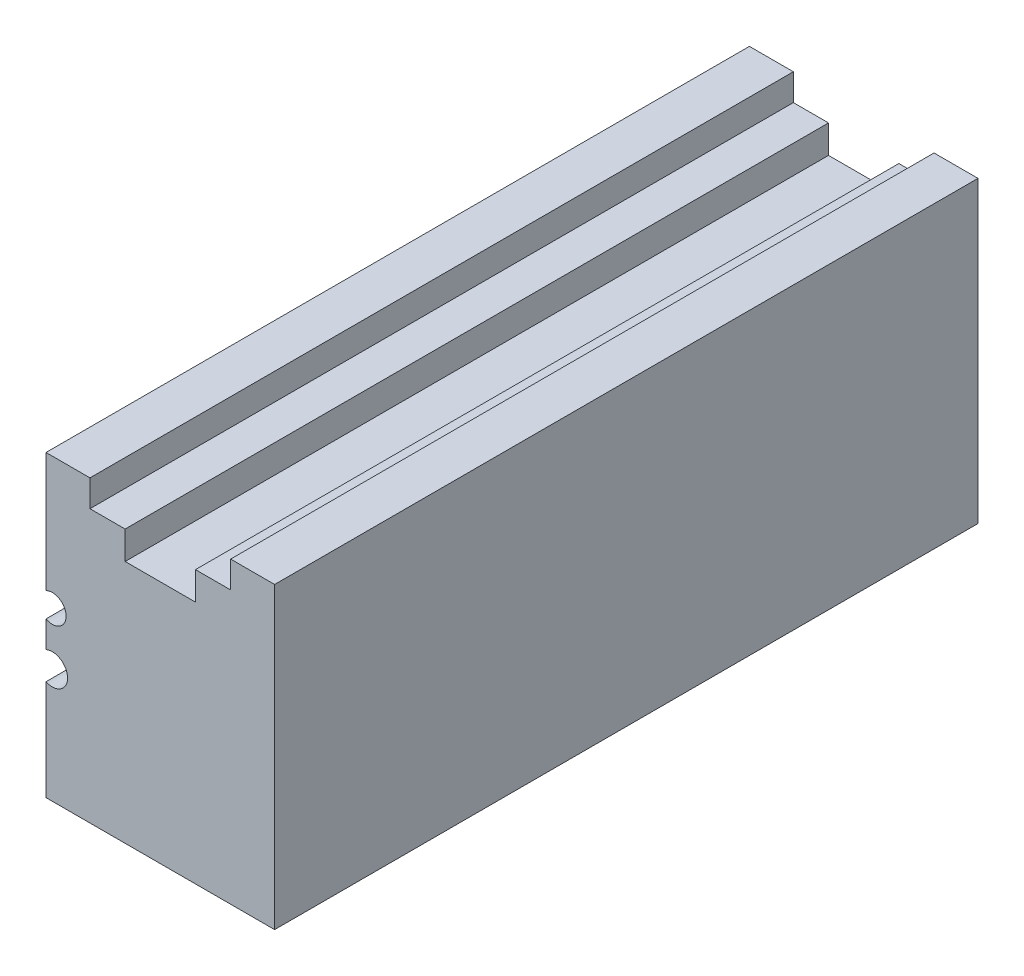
SolidWorks part; units mm, degrees
ref_plane "Front Plane" through (0, 0, 0) normal (0, 0, 1) x (1, 0, 0)
ref_plane "Top Plane" through (0, 0, 0) normal (0, 1, 0) x (1, 0, 0)
ref_plane "Right Plane" through (0, 0, 0) normal (1, 0, 0) x (0, 0, -1)
sketch "Sketch1" plane through (0, 0, 0) normal (0, 0, 1) x (1, 0, 0)
  line L1 (0, 0) -> (41.275, 0)
  line L2 (0, 0) -> (0, 53.975)
  line L3 (0, 53.975) -> (41.275, 53.975)
  line L4 (41.275, 0) -> (41.275, 53.975)
  dimension "D1" = 53.975
  dimension "D2" = 41.275
extrude "Boss-Extrude1" add sketch "Sketch1" against normal blind 127
sketch "Sketch2" plane through (0, 0, 0) normal (0, 0, 1) x (1, 0, 0)
  line L0 (41.275, 53.975) -> (0, 53.975) construction
  line L1 (7.9375, 53.975) -> (33.3375, 53.975)
  line L2 (7.9375, 53.975) -> (7.9375, 49.149)
  line L3 (7.9375, 49.149) -> (14.2875, 49.149)
  line L4 (33.3375, 53.975) -> (33.3375, 49.149)
  line L5 (26.9875, 49.149) -> (33.3375, 49.149)
  line L7 (14.2875, 49.149) -> (14.2875, 44.069)
  line L8 (14.2875, 44.069) -> (26.9875, 44.069)
  line L9 (26.9875, 49.149) -> (26.9875, 44.069)
  line L10 (41.275, 0) -> (41.275, 53.975) construction
  dimension "D1" = 25.4
  dimension "D2" = 12.7
  dimension "D3" = 6.35
  dimension "D4" = 7.9375
  dimension "D5" = 4.826
  dimension "D6" = 9.906
  dimension "D7" = 5.08
  dimension "D8" = 4.826
  dimension "D9" = 5.08
extrude "Cut-Extrude1" cut sketch "Sketch2" against normal blind 127
sketch "Sketch3" plane through (0, 0, 0) normal (0, -1, 0) x (1, 0, 0)
  line L0 (0, 0) -> (41.275, 0) construction
  line L1 (0, -127) -> (0, 0) construction
  circle A0 centre (20.6375, -25.4) radius 2.413
  circle A1 centre (4.7625, -63.5) radius 2.413
  circle A2 centre (36.5125, -63.5) radius 2.413
  circle A3 centre (20.6375, -101.6) radius 2.413
  dimension "D1" = 4.826
  dimension "D2" = 4.826
  dimension "D3" = 4.826
  dimension "D4" = 4.826
  dimension "D6" = 63.5
  dimension "D7" = 38.1
  dimension "D8" = 38.1
  dimension "D9" = 20.6375
  dimension "D10" = 20.6375
  dimension "D11" = 31.75
  dimension "D12" = 4.7625
  dimension "D5" = 63.5
extrude "Cut-Extrude2" cut sketch "Sketch3" against normal blind 6.35
hole_wizard "1/4-20 Tapped Hole1" positions "Sketch4" profile "Sketch5" tap size "1/4-20" standard "ANSI Inch"
sketch "Sketch4" plane through (0, 0, 0) normal (0, -1, 0) x (-1, 0, 0)
  line L0 (0, 127) -> (0, 0) construction
  circle A0 centre (-4.7625, 63.5) radius 2.413 construction
  circle A1 centre (-36.5125, 63.5) radius 2.413 construction
  point P0 (-4.7625, 38.1)
  point P2 (-36.5125, 38.1)
  point P4 (-36.5125, 88.9)
  point P6 (-4.7625, 88.9)
  dimension "D6" = 25.4
  dimension "D7" = 25.4
  dimension "D1" = 4.7625
  dimension "D2" = 31.75
  dimension "D3" = 36.5125
  dimension "D4" = 4.7625
  dimension "D5" = 25.4
  dimension "D8" = 31.75
sketch "Sketch5" plane through (4.7625, 0, -38.1) normal (1, 0, 0) x (0, 0, -1)
  line L0 (0, 0) -> (0, 12.9638)
  line L1 (0, 12.9638) -> (2.5527, 11.43)
  line L2 (2.5527, 11.43) -> (2.5527, 1.2573)
  line L3 (2.5527, 1.2573) -> (3.81, 0)
  line L5 (3.81, 0) -> (0, 0)
  line L6 (-2.5527, 1.2573) -> (-3.81, 0) construction
  line L10 (0, 12.9638) -> (-2.5527, 11.43) construction
  line L11 (0, -6.35) -> (0, 107.95) construction
  dimension "Tap Drill Dia." = 5.1054
  dimension "Tap Drill Depth" = 11.43
  dimension "Near C'Sink Dia." = 7.62
  dimension "Near C'Sink Angle" = 90
  dimension "Drill Angle" = 118
sketch "Sketch6" plane through (0, 0, 0) normal (0, 0, 1) x (1, 0, 0)
  line L0 (7.9375, 53.975) -> (0, 53.975) construction
  line L1 (0, 53.975) -> (0, 0) construction
  circle A0 centre (1.143, 30.1625) radius 2.4895
  circle A1 centre (1.143, 20.6375) radius 2.7554
  dimension "D2" = 9.525
  dimension "D1" = 23.8125
  dimension "D3" = 1.143
  dimension "D4" = 1.143
extrude "Cut-Extrude3" cut sketch "Sketch6" against normal blind 50.8
hole_wizard "#10-32 Tapped Hole1" positions "Sketch7" profile "Sketch8" tap size "#10-32" standard "ANSI Inch"
sketch "Sketch7" plane through (0, 0, 0) normal (-1, 0, 0) x (0, 0, 1)
  line L0 (-127, 0) -> (0, 0) construction
  line L1 (0, 18.1304) -> (0, 0) construction
  line L2 (-127, 53.975) -> (-127, 0) construction
  line L3 (-127, 53.975) -> (0, 53.975) construction
  point P0 (-120.015, 11.938)
  point P2 (-6.985, 11.938)
  point P11 (-63.5, 44.069)
  dimension "D1" = 11.938
  dimension "D2" = 11.938
  dimension "D3" = 6.985
  dimension "D4" = 6.985
  dimension "D5" = 63.5
  dimension "D6" = 9.906
sketch "Sketch8" plane through (0, 11.938, -120.015) normal (0, 1, 0) x (0, 0, 1)
  line L0 (0, 0) -> (0, 13.1513)
  line L1 (0, 13.1513) -> (2.0193, 11.938)
  line L2 (2.0193, 11.938) -> (2.0193, 1.0287)
  line L3 (2.0193, 1.0287) -> (3.048, 0)
  line L5 (3.048, 0) -> (0, 0)
  line L6 (-2.0193, 1.0287) -> (-3.048, 0) construction
  line L10 (0, 13.1513) -> (-2.0193, 11.938) construction
  line L11 (0, -6.35) -> (0, 107.95) construction
  dimension "Tap Drill Dia." = 4.0386
  dimension "Tap Drill Depth" = 11.938
  dimension "Near C'Sink Dia." = 6.096
  dimension "Near C'Sink Angle" = 90
  dimension "Drill Angle" = 118
